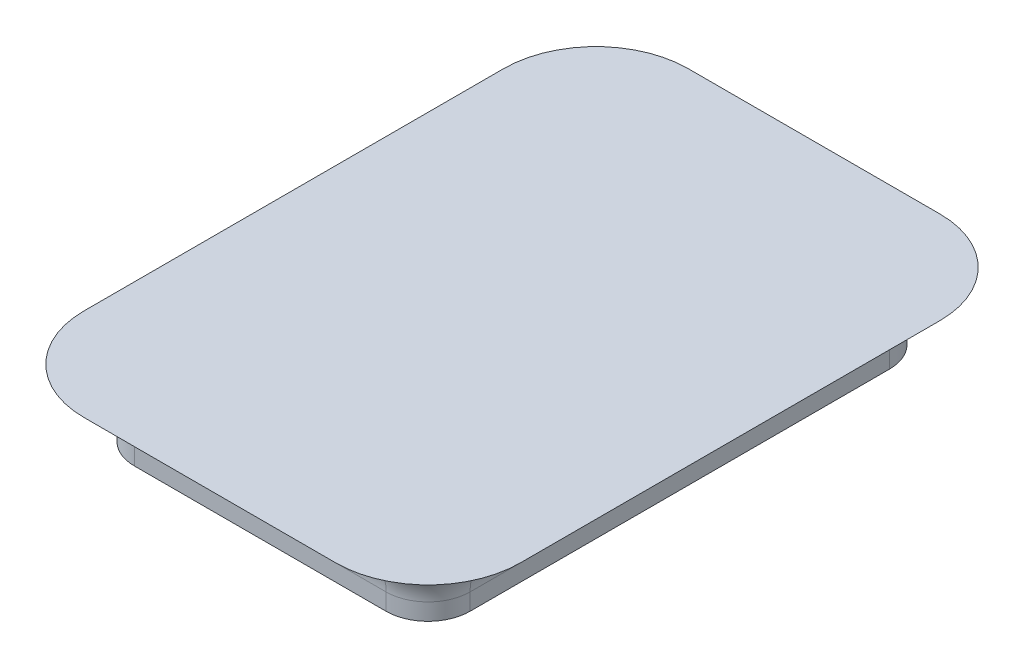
SolidWorks part; units mm, degrees
ref_plane "Plane1" through (0, 0, 0) normal (0, 0, 1) x (1, 0, 0)
ref_plane "Plane2" through (0, 0, 0) normal (0, 1, 0) x (1, 0, 0)
ref_plane "Plane3" through (0, 0, 0) normal (1, 0, 0) x (0, 0, -1)
sketch "Sketch1" plane through (0, 0, 0) normal (0, 0, 1) x (1, 0, 0)
  line L0 (-25, 5) -> (25, 5)
  line L1 (-25, 5) -> (-25, 0)
  line L2 (25, 0) -> (-25, 0)
  line L3 (25, 0) -> (25, 5)
  line L4 (0, 5) -> (0, 0) construction
  line L5 (50, 0) -> (-50, 0) construction
  dimension "D1" = 50
  dimension "D2" = 5
extrude "Base-Extrude" add sketch "Sketch1" along normal mid plane 50
sketch "Sketch3" plane through (0, 0, 0) normal (0, 0, 1) x (1, 0, 0)
  line L0 (0, 0) -> (0, -4) construction
  line L1 (-10, 0) -> (10, 0)
  line L2 (-10, 0) -> (-10, -4)
  line L3 (10, -4) -> (-10, -4)
  line L4 (10, -4) -> (10, 0)
  line L5 (25, 0) -> (-25, 0) construction
  dimension "Depth" = 20
  dimension "Height" = 4
extrude "Boss-Extrude1" add sketch "Sketch3" along normal mid plane 30
fillet "Fillet1" radius 2.5 4 edges at (-10, -2, -15) (10, -2, -15) (-10, -2, 15) (10, -2, 15)
fillet "Fillet2" radius 3 8 edges at (0, 0, 15) (10, 0, 0) (-10, 0, 0) (0, 0, -15) (9.2678, 0, 14.2678) (-9.2678, 0, 14.2678) (-9.2678, 0, -14.2678) (9.2678, 0, -14.2678)
sketch "Sketch4" plane through (25, 0, 0) normal (1, 0, 0) x (0, 0, -1)
  line L4 (25, 5) -> (-25, 5)
  line L5 (-25, 5) -> (-25, 0)
  line L6 (-25, 0) -> (25, 0)
  line L7 (25, 0) -> (25, 5)
  line L8 (25, 5) -> (-25, 5)
  line L9 (-25, 5) -> (-25, 0)
  line L10 (-25, 0) -> (25, 0)
  line L11 (25, 0) -> (25, 5)
  dimension "D1" = 0
extrude "Cut-Extrude1" cut sketch "Sketch4" against normal through all
sketch "Orientation sketch" plane through (0, 0, 0) normal (0, 1, 0) x (-1, 0, 0)
  line L4 (-7.5, -18) -> (7.5, -18)
  line L5 (13, -12.5) -> (13, 12.5)
  line L6 (7.5, 18) -> (-7.5, 18)
  line L7 (-13, 12.5) -> (-13, -12.5)
  line L8 (-7.5, -18) -> (7.5, -18)
  line L9 (13, -12.5) -> (13, 12.5)
  line L10 (7.5, 18) -> (-7.5, 18)
  line L11 (-13, 12.5) -> (-13, -12.5)
  arc A4 (-13, -12.5) -> (-7.5, -18) centre (-7.5, -12.5) ccw
  arc A5 (7.5, -18) -> (13, -12.5) centre (7.5, -12.5) ccw
  arc A6 (13, 12.5) -> (7.5, 18) centre (7.5, 12.5) ccw
  arc A7 (-7.5, 18) -> (-13, 12.5) centre (-7.5, 12.5) ccw
  arc A8 (-13, -12.5) -> (-7.5, -18) centre (-7.5, -12.5) ccw
  arc A9 (7.5, -18) -> (13, -12.5) centre (7.5, -12.5) ccw
  arc A10 (13, 12.5) -> (7.5, 18) centre (7.5, 12.5) ccw
  arc A11 (-7.5, 18) -> (-13, 12.5) centre (-7.5, 12.5) ccw
  dimension "D1" = 0
